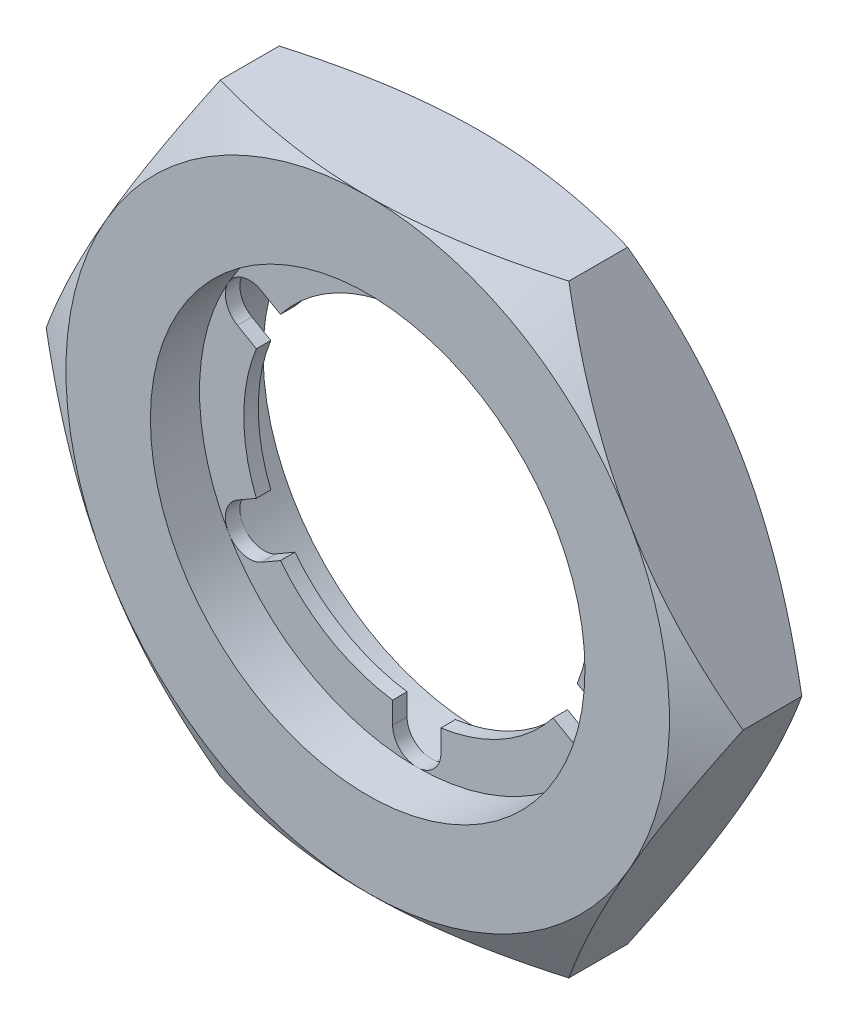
SolidWorks part; units mm, degrees
ref_plane "Front" through (0, 0, 0) normal (0, 0, 1) x (1, 0, 0)
ref_plane "Top" through (0, 0, 0) normal (0, 1, 0) x (1, 0, 0)
ref_plane "Right" through (0, 0, 0) normal (1, 0, 0) x (0, 0, -1)
sketch "Sketch1" plane through (0, 0, 0) normal (0, 0, 1) x (1, 0, 0)
  line L1 (21.6506, -37.5) -> (43.3013, 0)
  line L2 (43.3013, 0) -> (21.6506, 37.5)
  line L3 (21.6506, 37.5) -> (-21.6506, 37.5)
  line L4 (-21.6506, 37.5) -> (-43.3013, 0)
  line L5 (-43.3013, 0) -> (-21.6506, -37.5)
  line L6 (-21.6506, -37.5) -> (21.6506, -37.5)
  circle A0 centre (0, 0) radius 37.5 construction
  circle A1 centre (0, 0) radius 21.5
  dimension "d" = 43
  dimension "s" = 75
extrude "BaseNut" add sketch "Sketch1" against normal blind 14
sketch "Sketch2" plane through (23.5226, 0, -24.7401) normal (0, 1, 0) x (0, 0, -1)
  line L0 (-11.4787, 23.5226) -> (10.2613, 23.5226) construction
  line L2 (-24.7401, 61.0226) -> (-21.3907, 66.8239)
  line L5 (-21.3907, 66.8239) -> (-24.7401, 66.8239)
  line L6 (-24.7401, 66.8239) -> (-24.7401, 61.0226)
  line L7 (-17.7401, 76.3474) -> (-17.7401, 29.4794) construction
  line L8 (-10.7401, 66.8239) -> (-10.7401, 61.0226)
  line L9 (-14.0894, 66.8239) -> (-10.7401, 66.8239)
  line L10 (-10.7401, 61.0226) -> (-14.0894, 66.8239)
  dimension "D1" = 75
  dimension "D2" = 30
revolve "DoubleChamfer" cut sketch "Sketch2" angle 360 about L0
sketch "Sketch3" plane through (13.7868, 24.2734, 0) normal (0, 0, 1) x (0.866, 0.5, 0)
  line L0 (-43.4799, -14.128) -> (42.6103, -14.128) construction
  line L1 (-0.0765, -11.128) -> (-2.7868, -11.128)
  line L2 (-0.0765, -17.128) -> (-2.7868, -17.128)
  arc A0 (-50.9098, -11.1326) -> (-51.0765, -14.128) centre (-24.0765, -14.128) ccw construction
  arc A1 (-0.0765, -17.128) -> (-0.0765, -11.128) centre (-0.0765, -14.128) ccw
  arc A3 (-2.7868, -17.128) -> (-2.7868, -11.128) centre (-24.0765, -14.128) ccw
  circle A5 centre (-24.0765, -14.128) radius 21.5 construction
  dimension "D1" = 54
  dimension "n" = 3
extrude "Cut-Extrude1" cut sketch "Sketch3" against normal through all
pattern_circular "CirPattern1" count 6 over 360 about axis through (0, 0, 0) along (0, 0, 1) of "Cut-Extrude1"
ref_plane "Plane1" through (0, 0, -7) normal (0, 0, 1) x (1, 0, 0)
sketch "Sketch4" plane through (12.7705, 22.979, 0) normal (0, 0, 1) x (1, 0, 0)
  circle A1 centre (-12.7705, -22.979) radius 27
  dimension "D1" = 54
extrude "Cut-Extrude2" cut sketch "Sketch4" against normal offset from surface (6.1 mm away) 0.9
mirror "Mirror1" about plane through (0, 0, -7) normal (0, 0, 1) of "Cut-Extrude2"
sketch "Sketch5" plane through (0, 0, 0) normal (0, 1, 0) x (1, 0, 0)
  line L0 (21, 8.15) -> (21, 7.65)
  line L1 (21, 7.65) -> (21.5, 7.65)
  line L2 (21.5, 7.65) -> (21.933, 7.9)
  line L3 (21.933, 7.9) -> (21.5, 8.15)
  line L4 (21.5, 8.15) -> (21, 8.15)
  line L5 (0, 20.0501) -> (0, -4.257) construction
  line L6 (23.3827, 7.9) -> (0, 7.9) construction
  dimension "D1" = 0.5
  dimension "D2" = 43
revolve "Cut-Revolve10" [suppressed] cut sketch "Sketch5" angle 360 about L5
pattern_linear "LPattern10" [suppressed] count 3 spacing 0.6
equation "\"D1@Sketch4\" = \"D1@Sketch3\""
equation "\"D1@Sketch2\" = \"s@Sketch1\""
equation "\"D1@Plane1\"=\"m@BaseNut\"/2"
equation "\"D2@Sketch5\" = \"d@Sketch1\""
equation "\"D1@Sketch5\" = (  \"D2@ThreadCosmetic1\" - \"d@Sketch1\" )  / 10"
equation "\"D3@LPattern10\" = \"D1@Sketch5\" * 1.2"
equation "\"D1@LPattern10\" = \"w@Cut-Extrude2\" / \"D3@LPattern10\" * 2"
